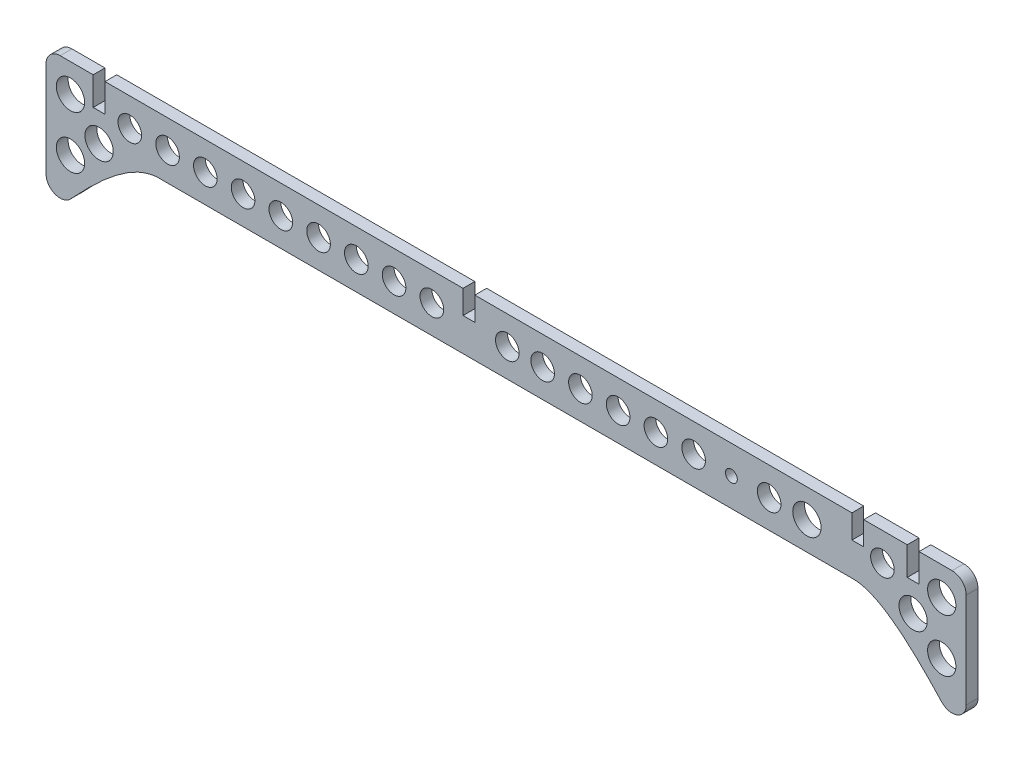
SolidWorks part; units mm, degrees
ref_plane "Front Plane" through (0, 0, 0) normal (0, 0, 1) x (1, 0, 0)
ref_plane "Top Plane" through (0, 0, 0) normal (0, 1, 0) x (1, 0, 0)
ref_plane "Right Plane" through (0, 0, 0) normal (1, 0, 0) x (0, 0, -1)
sketch "Sketch1" plane through (0, 0, 0) normal (0, 0, 1) x (1, 0, 0)
  line L0 (107.95, 0) -> (111.125, 0)
  line L1 (-123.825, 0) -> (-123.825, 3.81)
  line L2 (-123.825, 0) -> (-123.825, -21.7847)
  line L3 (107.95, 7.62) -> (96.2481, 7.62)
  line L4 (93.4694, -7.62) -> (-93.4694, -7.62)
  line L5 (-111.125, 7.62) -> (-111.125, 0)
  line L6 (-107.95, 7.62) -> (-107.95, 0)
  line L7 (-111.125, 7.62) -> (-120.015, 7.62)
  line L8 (0, 7.62) -> (0, -29.0621) construction
  line L9 (111.125, 7.62) -> (120.015, 7.62)
  line L10 (107.95, 7.62) -> (107.95, 0)
  line L11 (111.125, 7.62) -> (111.125, 0)
  line L12 (123.825, 0) -> (123.825, -21.7847)
  line L13 (123.825, 0) -> (123.825, 3.81)
  line L14 (93.0731, 7.62) -> (93.0731, 1.27)
  line L15 (-107.95, 0) -> (-111.125, 0)
  line L16 (93.0731, 1.27) -> (96.2481, 1.27)
  line L17 (96.2481, 1.27) -> (96.2481, 7.62)
  line L18 (93.0731, 7.62) -> (-8.4149, 7.62)
  line L19 (-11.5899, 7.62) -> (-11.5899, 1.27)
  line L20 (-11.5899, 1.27) -> (-8.4149, 1.27)
  line L21 (-8.4149, 1.27) -> (-8.4149, 7.62)
  line L22 (-11.5899, 7.62) -> (-107.95, 7.62)
  arc A0 (-123.825, -21.7847) -> (-117.24, -24.3953) centre (-120.015, -21.7847) ccw
  arc A1 (-123.825, 3.81) -> (-120.015, 7.62) centre (-120.015, 3.81) cw
  circle A2 centre (-117.24, 0) radius 3.81
  circle A3 centre (-101.2713, 0) radius 3.175
  circle A4 centre (-91.1113, 0) radius 3.175
  circle A5 centre (-80.9513, 0) radius 3.175
  circle A6 centre (-70.7913, 0) radius 3.175
  circle A7 centre (-60.6313, 0) radius 3.175
  circle A8 centre (-50.4713, 0) radius 3.175
  circle A9 centre (-40.3113, 0) radius 3.175
  circle A10 centre (-30.1513, 0) radius 3.175
  circle A11 centre (-19.9913, 0) radius 3.175
  circle A13 centre (0.3287, 0) radius 3.175
  circle A14 centre (9.8313, 0) radius 3.175
  circle A15 centre (19.9913, 0) radius 3.175
  circle A16 centre (30.1513, 0) radius 3.175
  circle A17 centre (40.3113, 0) radius 3.175
  circle A18 centre (50.4713, 0) radius 3.175
  circle A20 centre (70.7913, 0) radius 3.175
  circle A21 centre (80.9513, 0) radius 3.81
  circle A23 centre (101.2713, 0) radius 3.175
  circle A24 centre (117.24, 0) radius 3.81
  arc A25 (123.825, 3.81) -> (120.015, 7.62) centre (120.015, 3.81) ccw
  arc A26 (123.825, -21.7847) -> (117.24, -24.3953) centre (120.015, -21.7847) cw
  circle A27 centre (-109.5375, -7.62) radius 3.81
  circle A28 centre (-117.24, -14.2125) radius 3.81
  circle A29 centre (117.24, -14.2125) radius 3.81
  circle A30 centre (109.5375, -7.62) radius 3.81
  circle A31 centre (-80.9513, 0) radius 3.175
  circle A32 centre (60.6313, 0) radius 1.5875
  arc A33 (-11.5899, 2.6435) -> (-8.4149, 2.8415) centre (-9.8313, 0) ccw
  spline S0 degree 3 poles (-117.24, -24.3953) (-110.981, -17.7422) (-101.3765, -7.6603) (-93.4694, -7.62) knots 0.386367 0.386367 0.386367 0.386367 1 1 1 1
  spline S1 degree 3 poles (117.24, -24.3953) (110.981, -17.7422) (101.3765, -7.6603) (93.4694, -7.62) knots 0.386367 0.386367 0.386367 0.386367 1 1 1 1
  point P14 (-123.825, 7.62)
  point P71 (0, -7.62)
  point P76 (123.825, 7.62)
  dimension "D1" = 3.81
  dimension "D2" = 3.81
  dimension "D3" = 15.24
  dimension "D4" = 123.825
  dimension "D5" = 12.7
  dimension "D6" = 3.175
  dimension "D7" = 11
extrude "Boss-Extrude1" add sketch "Sketch1" along normal blind 3.175
